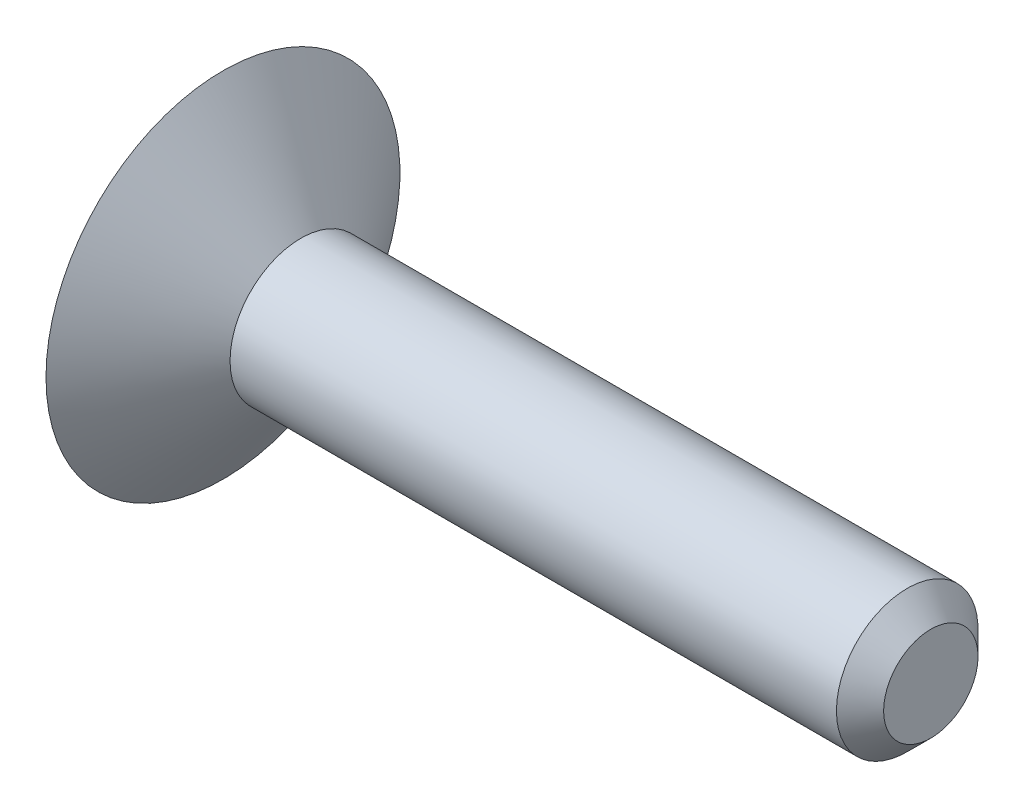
SolidWorks part; units mm, degrees
ref_plane "Plan1" through (0, 0, 0) normal (0, 0, 1) x (1, 0, 0)
ref_plane "Plan2" through (0, 0, 0) normal (0, 1, 0) x (1, 0, 0)
ref_plane "Plan3" through (0, 0, 0) normal (1, 0, 0) x (0, 0, -1)
sketch "Esquisse1" plane through (0, 0, 0) normal (0, 0, 1) x (1, 0, 0)
  line L0 (-28.5762, 0) -> (32.6169, 0) construction
  line L1 (0, 0) -> (0, 7.5)
  line L2 (0, 7.5) -> (3.3, 3)
  line L5 (3.3, 3) -> (29, 3)
  line L6 (29, 3) -> (30, 2)
  line L7 (30, 2) -> (30, 0)
  line L8 (30, 0) -> (0, 0)
  dimension "D1" = 1
  dimension "D2" = 1
  dimension "D3" = 3.3
  dimension "D4" = 7.5
  dimension "D5" = 30
revolve "Base-Révolution" add sketch "Esquisse1" angle 360 about L0
sketch "Esquisse2" plane through (0, 5.4655, -1.3914) normal (-1, 0, 0) x (0, 0, 1)
  line L4 (-0.5046, -7.6591) -> (-1.508, -5.4655)
  line L5 (2.8032, -7.998) -> (-0.5046, -7.6591)
  line L8 (4.2909, -5.4655) -> (2.8032, -7.998)
  line L9 (-1.508, -5.4655) -> (-0.0203, -2.9329)
  line L11 (-0.0203, -2.9329) -> (3.2874, -3.2718)
  line L13 (3.2874, -3.2718) -> (4.2909, -5.4655)
  dimension "D1" = 5
  dimension "D2" = 4.7509
  dimension "D3" = 5.2734
extrude "Enlèv. mat.-Extru.1" cut sketch "Esquisse2" against normal blind 3
